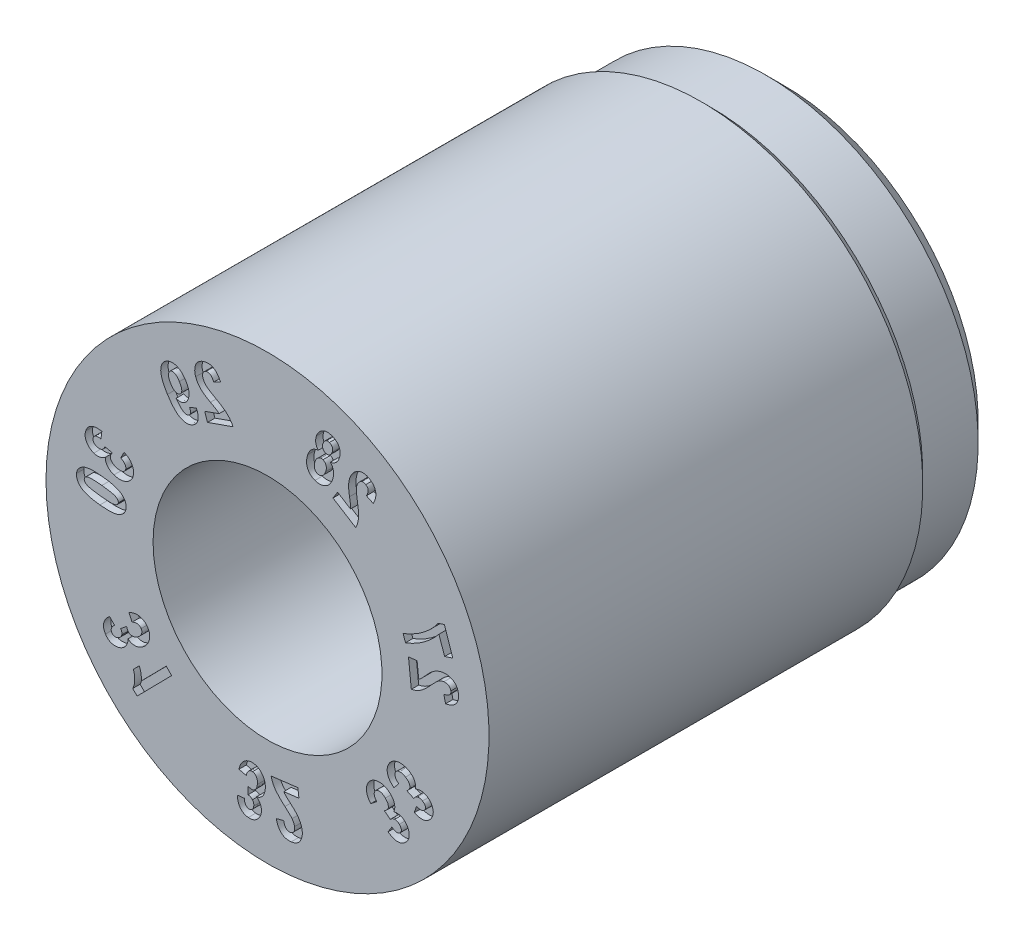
SolidWorks part; units mm, degrees
ref_plane "Front Plane" through (0, 0, 0) normal (0, 0, 1) x (1, 0, 0)
ref_plane "Top Plane" through (0, 0, 0) normal (0, 1, 0) x (1, 0, 0)
ref_plane "Right Plane" through (0, 0, 0) normal (1, 0, 0) x (0, 0, -1)
sketch "Sketch2" plane through (0, 0, 0) normal (0, 1, 0) x (1, 0, 0)
  line L0 (0, 4.8491) -> (0, -49995.1509) construction
  line L10 (5.2496, 14) -> (1.5, 14)
  line L11 (5.75, 13.4996) -> (5.2496, 14)
  line L12 (5.75, 12) -> (5.75, 13.4996)
  line L13 (6, 11.75) -> (5.75, 12)
  line L14 (6, 0) -> (6, 11.75)
  line L15 (3.1, 0) -> (6, 0)
  line L16 (3.1, 0) -> (3.1, 10)
  line L17 (1.5, 10) -> (3.1, 10)
  line L18 (1.5, 10) -> (1.5, 14)
  dimension "D1" = 12
  dimension "D2" = 6.2
  dimension "D3" = 4
  dimension "D4" = 3
  dimension "D5" = 11.5
  dimension "D6" = 14
  dimension "D7" = 45
  dimension "D8" = 45
  dimension "D9" = 2
  dimension "D10" = 0.5004
revolve "Revolve1" add sketch "Sketch2" angle 360 about L0
sketch "Sketch9" plane through (0, 0, 0) normal (0, 0, 1) x (1, 0, 0)
  line L0 (0, 0) -> (4.691, 3.7409) construction
  line L1 (0, 0) -> (5.8496, -1.3351) construction
  line L2 (0, 0) -> (2.6033, -5.4058) construction
  line L3 (0, 0) -> (-2.6033, -5.4058) construction
  line L4 (0, 0) -> (-5.8496, -1.3351) construction
  line L5 (0, 0) -> (-4.691, 3.7409) construction
  line L97 (0, 0) -> (0, 6) construction
  circle A30 centre (0, 0) radius 3.8998 construction
  circle A31 centre (0, 0) radius 6 construction
  text T0 "27    28    29    30    31    32    33" font "Arial Narrow" height 1.32
  point P9 (0, 0)
  dimension "D1" = 7
extrude "Cut-Extrude3" cut sketch "Sketch9" against normal blind 0.2
